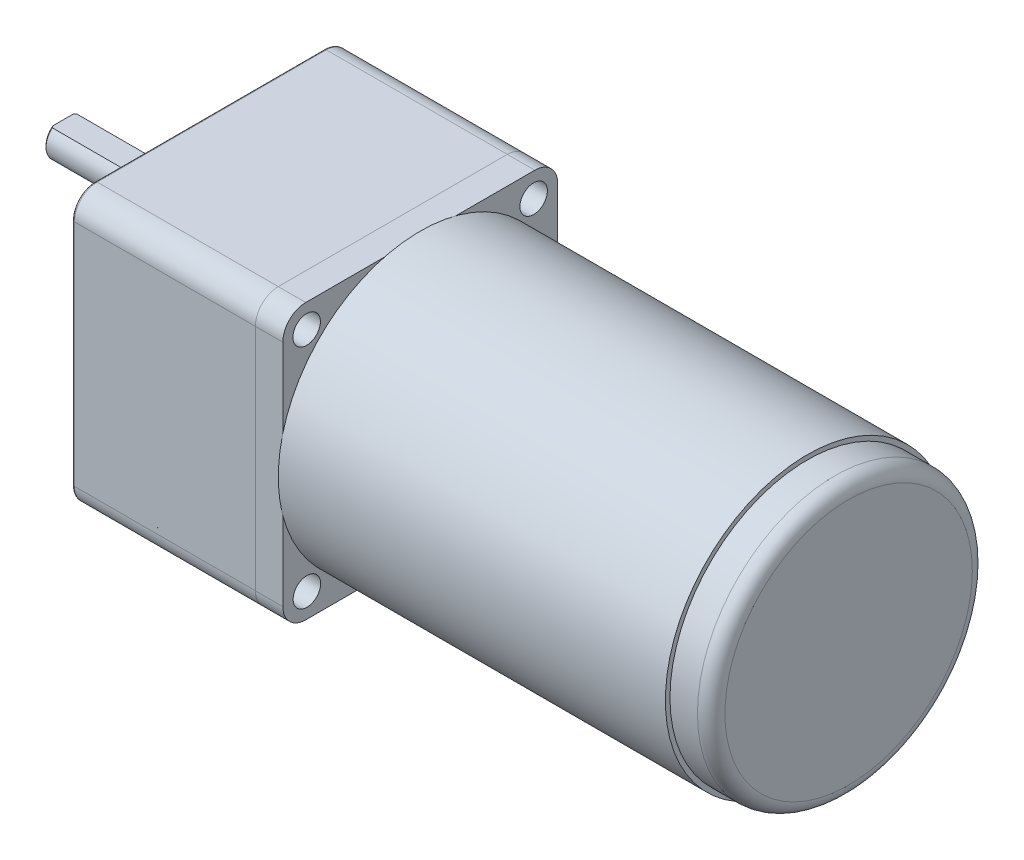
SolidWorks part; units mm, degrees
ref_plane "前视基准面" through (0, 0, 0) normal (0, 0, 1) x (1, 0, 0)
ref_plane "上视基准面" through (0, 0, 0) normal (0, 1, 0) x (1, 0, 0)
ref_plane "右视基准面" through (0, 0, 0) normal (1, 0, 0) x (0, 0, -1)
sketch "草图1" plane through (0, 0, 0) normal (1, 0, 0) x (0, 0, -1)
  line L1 (-25, -30) -> (25, -30)
  line L2 (-30, -25) -> (-30, 25)
  line L3 (-25, 30) -> (25, 30)
  line L4 (30, -25) -> (30, 25)
  line L5 (-30, -30) -> (30, 30) construction
  line L6 (-30, 30) -> (30, -30) construction
  arc A0 (-25, -30) -> (-30, -25) centre (-25, -25) cw
  arc A1 (25, -30) -> (30, -25) centre (25, -25) ccw
  arc A2 (25, 30) -> (30, 25) centre (25, 25) cw
  arc A3 (-30, 25) -> (-25, 30) centre (-25, 25) cw
  point P0 (0, 0)
  dimension "D1" = 5
extrude "凸台-拉伸1" add sketch "草图1" along normal blind 40
sketch "草图2" plane through (40, 0, 0) normal (1, 0, 0) x (0, 0, -1)
  line L0 (25, 30) -> (-25, 30) construction
  line L1 (-25, -30) -> (25, -30)
  line L2 (-30, -25) -> (-30, 25)
  line L3 (-25, 30) -> (25, 30)
  line L4 (30, -25) -> (30, 25)
  line L5 (-30, -30) -> (30, 30) construction
  line L6 (-30, 30) -> (30, -30) construction
  arc A0 (25, 30) -> (30, 25) centre (25, 25) cw
  arc A1 (25, -30) -> (30, -25) centre (25, -25) ccw
  arc A2 (-25, -30) -> (-30, -25) centre (-25, -25) cw
  arc A3 (-30, 25) -> (-25, 30) centre (-25, 25) cw
  point P0 (0, 0)
  dimension "D1" = 5
extrude "凸台-拉伸2" add sketch "草图2" along normal blind 6 separate body
sketch "草图5" plane through (0, 0, 0) normal (-1, 0, 0) x (0, 0, 1)
  circle A0 centre (0, 10) radius 12
extrude "凸台-拉伸5" add sketch "草图5" along normal blind 3 separate body
sketch "草图6" plane through (-3, 0, 0) normal (-1, 0, 0) x (0, 0, 1)
  circle A0 centre (0, 10) radius 4
extrude "凸台-拉伸6" add sketch "草图6" along normal blind 29 separate body
fillet "圆角2" radius 0.5 1 edges at (-3, 10, 12)
sketch "草图7" plane through (-32, 0, 0) normal (-1, 0, 0) x (0, 0, 1)
  line L2 (2.6458, 13) -> (-2.6458, 13)
  arc A0 (2.6458, 13) -> (-2.6458, 13) centre (0, 10) ccw
extrude "切除-拉伸1" cut sketch "草图7" against normal blind 25
chamfer "倒角1" distance 0.3 angle 45 1 edges at (-32, 6, 0)
sketch "草图8" plane through (0, 0, 0) normal (-1, 0, 0) x (0, 0, 1)
  circle A0 centre (0, 0) radius 26.3
extrude "切除-拉伸2" cut sketch "草图8" against normal blind 0.5
fillet "圆角3" radius 0.5 1 edges at (0, 0, 26.3)
fillet "圆角4" radius 0.5 8 edges at (0, -30, 0) (0, -28.5355, -28.5355) (0, 0, -30) (0, 28.5355, -28.5355) (0, 30, 0) (0, 28.5355, 28.5355) (0, 0, 30) (0, -28.5355, 28.5355)
sketch "草图9" plane through (0, 0, 0) normal (-1, 0, 0) x (0, 0, 1)
  point P19 (-24.7487, 24.7487)
  point P20 (24.7487, 24.7487)
  point P21 (24.7487, -24.7487)
  point P22 (-24.7487, -24.7487)
hole_wizard "M4 螺纹孔1" positions "3D草图1" profile "草图10" tap size "M4" standard "GB"
sketch3d "3D草图1"
  point P0 (0, 24.7487, -24.7487)
  point P3 (0, 24.7487, 24.7487)
  point P6 (0, -24.7487, 24.7487)
  point P9 (0, -24.7487, -24.7487)
sketch "草图10" plane through (0, 24.7487, -24.7487) normal (0, 1, 0) x (0, 0, 1)
  line L0 (0, 0) -> (0, 12.9914)
  line L1 (0, 12.9914) -> (1.65, 12)
  line L2 (1.65, 12) -> (1.65, 0)
  line L5 (1.65, 0) -> (0, 0)
  line L10 (0, 12.9914) -> (-1.65, 12) construction
  line L11 (0, -6.35) -> (0, 107.95) construction
  dimension "螺纹孔钻头直径" = 3.3
  dimension "螺纹孔钻头深度" = 12
  dimension "导头角度" = 118
sketch "草图11" plane through (46, 0, 0) normal (1, 0, 0) x (0, 0, -1)
  circle A5 centre (-24.8007, 24.8007) radius 3
  circle A6 centre (24.7487, 24.7487) radius 3
  circle A7 centre (24.7487, -24.7487) radius 3
  circle A8 centre (-24.7487, -24.7487) radius 3
extrude "切除-拉伸3" cut sketch "草图11" against normal blind 34
sketch "草图12" plane through (46, 0, 0) normal (1, 0, 0) x (0, 0, -1)
  circle A0 centre (0, 0) radius 31
extrude "凸台-拉伸7" add sketch "草图12" along normal blind 84.5 separate body
sketch "草图13" plane through (130.5, 0, 0) normal (1, 0, 0) x (0, 0, -1)
  circle A0 centre (0, 0) radius 30
extrude "凸台-拉伸8" add sketch "草图13" along normal blind 9 separate body
fillet "圆角5" radius 3 1 edges at (139.5, 0, -30)
